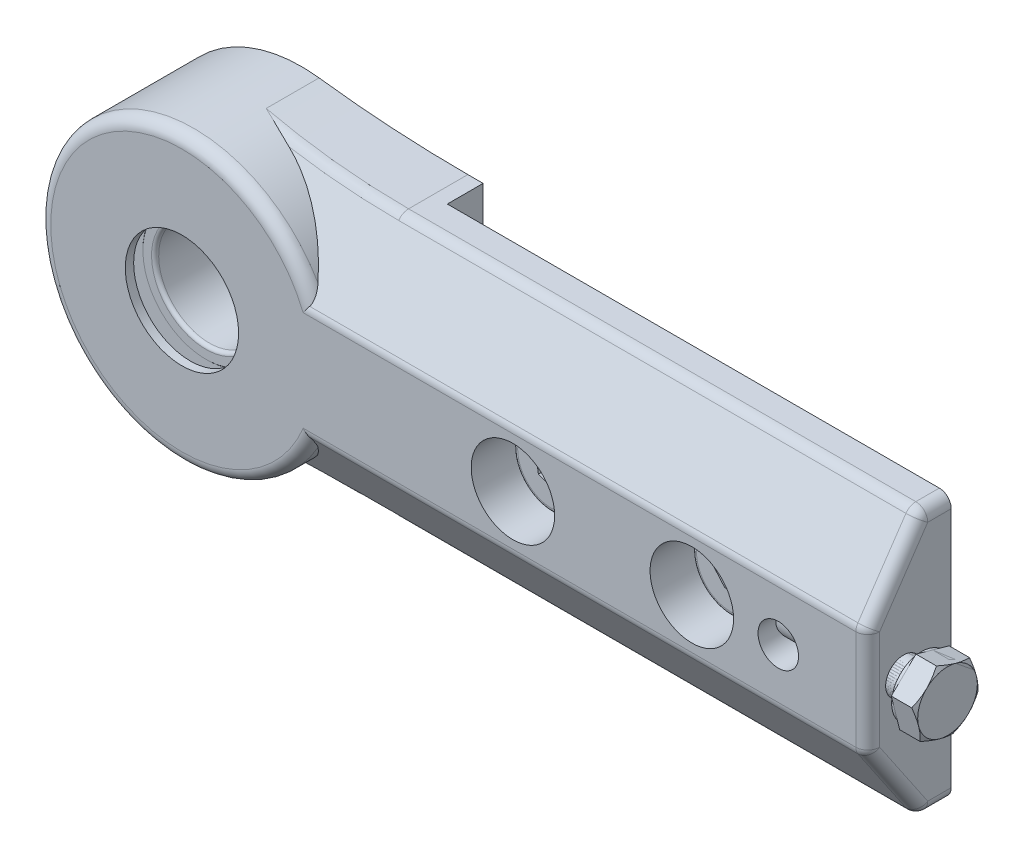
SolidWorks part; units mm, degrees
ref_plane "Front Plane" through (0, 0, 0) normal (0, 0, 1) x (1, 0, 0)
ref_plane "Top Plane" through (0, 0, 0) normal (0, 1, 0) x (1, 0, 0)
ref_plane "Right Plane" through (0, 0, 0) normal (1, 0, 0) x (0, 0, -1)
imported_body "socket head thin cap screw_din-1-solid1"
imported_body "socket head thin cap screw_din-2-solid1"
imported_body "hex screw gradec_din-1-solid1"
imported_body "1.2014 Neliömutteri M8 kiinnityslevyllä-1-solid1"
imported_body "1.2014 Neliömutteri M8 kiinnityslevyllä-2-solid1"
imported_body "1.8065 Kulj. laakeri 45_25 reiällä-2-solid1"
imported_body "2203-2RS-1-surface1"
imported_body "2203-2RS-1-surface2"
hole_wizard "M8 Tapped Hole1" positions "Sketch1" profile "Sketch3" tap size "M8" standard "DIN"
sketch "Sketch1" plane through (0, 0, 27.6804) normal (0, 0, 1) x (1, 0, 0)
  line L0 (-185.1637, -4.7358) -> (-100.1089, -4.7358) construction
  circle A0 centre (-213.1089, -26.9858) radius 8.5 construction
  point P0 (-113.1089, -26.9858)
  dimension "D1" = 100
  dimension "D2" = 22.25
sketch "Sketch3" plane through (-113.1089, -26.9858, 27.6804) normal (1, 0, 0) x (0, -1, 0)
  line L0 (0, 0) -> (0, 16.0429)
  line L1 (0, 16.0429) -> (3.4, 14)
  line L2 (3.4, 14) -> (3.4, 0)
  line L5 (3.4, 0) -> (0, 0)
  line L10 (0, 16.0429) -> (-3.4, 14) construction
  line L11 (0, -6.35) -> (0, 107.95) construction
  dimension "Tap Drill Dia." = 6.8
  dimension "Tap Drill Depth" = 14
  dimension "Drill Angle" = 118
